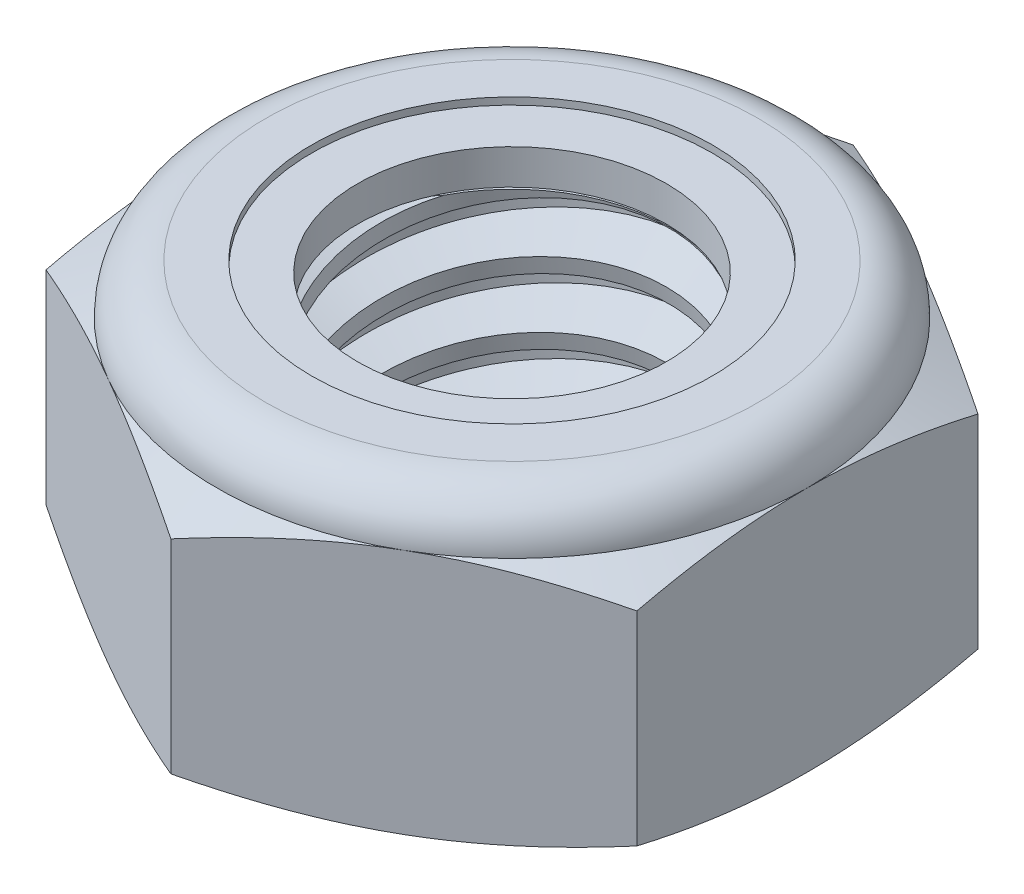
SolidWorks part; units mm, degrees
ref_plane "Front" through (0, 0, 0) normal (0, 0, 1) x (1, 0, 0)
ref_plane "Top" through (0, 0, 0) normal (0, 1, 0) x (1, 0, 0)
ref_plane "Right" through (0, 0, 0) normal (1, 0, 0) x (0, 0, -1)
sketch "Sketch1" plane through (0, 0, 0) normal (0, 1, 0) x (1, 0, 0)
  line L1 (0, 7.3323) -> (-6.35, 3.6662)
  line L2 (-6.35, 3.6662) -> (-6.35, -3.6662)
  line L3 (-6.35, -3.6662) -> (0, -7.3323)
  line L4 (0, -7.3323) -> (6.35, -3.6662)
  line L5 (6.35, -3.6662) -> (6.35, 3.6662)
  line L6 (6.35, 3.6662) -> (0, 7.3323)
  circle A0 centre (0, 0) radius 6.35 construction
  dimension "Hex Flats" = 12.7
extrude "Extrude1" add sketch "Sketch1" along normal blind 6.35
sketch "Sketch2" plane through (0, 0, 0) normal (1, 0, 0) x (0, 0, -1)
  line L0 (-3.9624, 0) -> (-3.9624, 6.35) construction
  line L1 (0, 0) -> (3.9624, 0)
  line L2 (0, 0) -> (0, 6.35)
  line L3 (0, 6.35) -> (3.9624, 6.35)
  line L4 (3.9624, 0) -> (3.9624, 6.35)
  line L5 (-3.6662, 6.35) -> (3.6662, 6.35) construction
  line L7 (0, -3.9624) -> (0, 0) construction
  dimension "Thread Dia" = 7.9248
revolve "Revolve1" add sketch "Sketch2" angle 360 about L7
sketch "Sketch3" plane through (0, 0, 0) normal (1, 0, 0) x (0, 0, -1)
  line L0 (3.9624, 6.35) -> (-3.9624, 6.35) construction
  line L1 (-3.9624, 6.35) -> (-3.9624, 4.9389) construction
  line L2 (-3.9624, 4.9389) -> (3.9624, 6.35) construction
  line L3 (3.9624, 6.35) -> (3.9933, 6.1763) construction
  line L4 (3.9933, 6.1763) -> (4.2098, 4.9607)
  line L5 (4.2098, 4.9607) -> (3.3805, 5.261)
  line L6 (3.3805, 5.261) -> (3.3187, 5.6083)
  line L7 (3.3187, 5.6083) -> (3.9933, 6.1763)
  line L8 (3.3496, 5.4346) -> (4.1015, 5.5685) construction
  line L9 (3.9624, 6.35) -> (3.9624, 5.5438) construction
  line L10 (3.9624, 5.5438) -> (-3.9624, 4.1327) construction
  line L11 (-3.9624, 4.1327) -> (-3.9624, 4.9389) construction
  line L12 (-0.2692, 6.35) -> (0.2692, 3.3264) construction
  line L13 (-3.9624, 0) -> (-3.9624, 6.35) construction
  line L14 (0, 6.35) -> (3.9624, 6.35) construction
  line L15 (3.9624, 0) -> (3.9624, 6.35) construction
  point P13 (0, 4.8382)
revolve "Cut-Revolve1" cut sketch "Sketch3" angle 360 about L12
pattern_linear "LPattern1" count 4 spacing 1.4111 along (0, -1, 0) count 2 spacing 1.4111 along (0, 1, 0) of "Cut-Revolve1"
sketch "Sketch4" plane through (0, 0, 0) normal (1, 0, 0) x (0, 0, -1)
  line L0 (0, 6.35) -> (3.9624, 6.35)
  line L1 (3.9624, 6.35) -> (3.3187, 6.0498)
  line L2 (3.3187, 6.0498) -> (3.3187, 0.3002)
  line L3 (3.3187, 0.3002) -> (3.9624, 0)
  line L4 (3.9624, 0) -> (0, 0)
  line L5 (0, 0) -> (0, 6.35)
  line L6 (3.9624, 0) -> (3.9624, 6.35) construction
  line L7 (0, 6.35) -> (3.9624, 6.35) construction
  line L8 (0, 0) -> (3.9624, 0) construction
  line L9 (0, 0) -> (0, 6.35) construction
  line L10 (0, 6.35) -> (0, 7.0603) construction
  dimension "D1" = 25
revolve "Cut-Revolve2" cut sketch "Sketch4" angle 360 about L10
combine bodies "Combine1" operation type subtract main body 112 bodies to subtract 111
sketch "Sketch5" plane through (0, 0, 0) normal (1, 0, 0) x (0, 0, -1)
  line L0 (0, 0) -> (6.35, 0)
  line L1 (6.35, 0) -> (7.3323, 0.4581)
  line L2 (7.3323, 0.4581) -> (7.3323, 4.8336)
  line L3 (7.3323, 4.8336) -> (6.35, 5.2917)
  line L4 (5.2917, 6.35) -> (5.2917, 7.62)
  line L5 (5.2917, 7.62) -> (8.6023, 7.62)
  line L6 (8.6023, 7.62) -> (8.6023, -1.27)
  line L7 (8.6023, -1.27) -> (0, -1.27)
  line L8 (0, -1.27) -> (0, 0)
  line L9 (6.35, 5.2917) -> (6.35, 0) construction
  line L10 (0, 0) -> (3.9624, 0) construction
  line L13 (7.3323, 2.6458) -> (8.6023, 2.6458) construction
  line L14 (7.3323, 6.35) -> (7.3323, 0) construction
  line L15 (0, 0) -> (0, 7.62) construction
  line L20 (0, 7.62) -> (5.2917, 7.62) construction
  line L22 (0, 6.35) -> (3.9624, 6.35) construction
  arc A0 (6.35, 5.2917) -> (5.2917, 6.35) centre (5.2917, 5.2917) ccw
revolve "Cut-Revolve3" cut sketch "Sketch5" angle 360 about L15
sketch "Sketch6" plane through (0, 0, 0) normal (1, 0, 0) x (0, 0, -1)
  line L0 (0, 5.2917) -> (6.1976, 5.2917)
  line L1 (5.2917, 6.1976) -> (4.3052, 6.1976)
  line L2 (0, 7.62) -> (0, 5.2917)
  line L3 (4.3052, 7.62) -> (0, 7.62)
  line L4 (0, 7.62) -> (5.2917, 7.62) construction
  line L5 (0, 0) -> (0, 7.62) construction
  line L6 (0, 7.62) -> (0, 44.323) construction
  line L7 (4.3052, 6.1976) -> (4.3052, 7.62)
  line L8 (5.2917, 6.35) -> (5.2917, 6.1976) construction
  line L9 (4.3052, 6.1976) -> (3.3187, 6.1976) construction
  line L10 (3.3187, 6.1976) -> (3.3187, 6.0498) construction
  arc A0 (6.1976, 5.2917) -> (5.2917, 6.1976) centre (5.2917, 5.2917) ccw
  arc A1 (6.35, 5.2917) -> (5.2917, 6.35) centre (5.2917, 5.2917) ccw construction
  dimension "D1" = 0.1524
revolve "Cut-Revolve4" cut sketch "Sketch6" angle 360 about L6
sketch "Sketch7" plane through (0, 0, 0) normal (1, 0, 0) x (0, 0, -1)
  line L0 (3.3187, 5.3679) -> (6.1179, 5.3679)
  line L1 (5.2917, 6.1214) -> (3.3187, 6.1214)
  line L2 (3.3187, 6.1214) -> (3.3187, 5.3679)
  line L3 (3.3187, 5.3679) -> (0, 5.3679) construction
  line L4 (0, 5.3679) -> (0, 6.1214) construction
  line L5 (0, 6.1214) -> (3.3187, 6.1214) construction
  line L6 (3.3187, 5.3679) -> (3.3187, 5.2917) construction
  line L7 (0, 5.2917) -> (6.1976, 5.2917) construction
  line L8 (5.2917, 6.1214) -> (5.2917, 6.1976) construction
  arc A0 (6.1179, 5.3679) -> (5.2917, 6.1214) centre (5.2917, 5.2917) ccw
  arc A2 (6.1976, 5.2917) -> (5.2917, 6.1976) centre (5.2917, 5.2917) ccw construction
  dimension "D1" = 0.0762
revolve "Revolve2" add sketch "Sketch7" angle 360 about L4
equation "\"D1@Sketch3\"=\"Thread Pitch@Sketch3\"/8"
equation "\"D2@Sketch3\"=\"Thread Pitch@Sketch3\"/4"
equation "\"D5@Sketch3\"=\"Thread Pitch@Sketch3\""
equation "\"D4@LPattern1\"=\"Thread Pitch@Sketch3\""
equation "\"D3@LPattern1\"=\"Thread Pitch@Sketch3\""
equation "\"D1@LPattern1\"=\"Height@Extrude1\"/\"Thread Pitch@Sketch3\""
equation "\"D4@Sketch5\"=\"Height@Extrude1\"/6"
